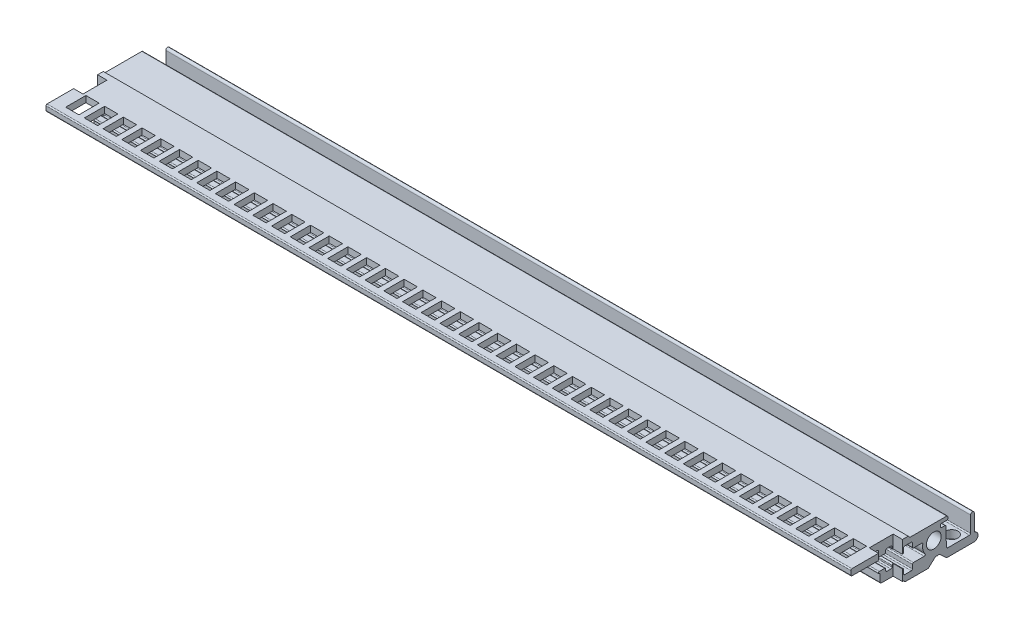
SolidWorks part; units mm, degrees
ref_plane "前视基准面" through (0, 0, 0) normal (0, 0, 1) x (1, 0, 0)
ref_plane "上视基准面" through (0, 0, 0) normal (0, 1, 0) x (1, 0, 0)
ref_plane "右视基准面" through (0, 0, 0) normal (1, 0, 0) x (0, 0, -1)
sketch "草图1" plane through (0, 0, 0) normal (1, 0, 0) x (0, 0, -1)
  line L901 (2.0061, 2.1458) -> (2.0561, 2.1458)
  line L902 (2.2561, 1.9458) -> (2.2561, -0.0542)
  line L903 (2.5561, -0.3542) -> (6.0561, -0.3542)
  line L904 (6.546, -0.7542) -> (12.6401, -0.7542)
  line L905 (12.8419, -0.6762) -> (14.6823, 0.9969)
  line L906 (15.8298, 0.9969) -> (17.6702, -0.6762)
  line L907 (17.872, -0.7542) -> (25.1561, -0.7542)
  line L908 (25.2561, 1.6874) -> (25.2561, 6.0458)
  line L909 (24.2561, 6.0458) -> (24.2561, 1.7458)
  line L910 (23.9561, 1.4458) -> (18.0561, 1.4458)
  line L911 (17.7561, 1.7458) -> (17.7561, 3.0993)
  line L912 (17.5561, 3.4458) -> (17.5561, 6.7458)
  line L913 (17.2561, 7.0458) -> (16.3561, 7.0458)
  line L914 (16.0561, 7.3458) -> (16.0561, 7.7458)
  line L915 (16.3561, 8.0458) -> (17.7561, 8.0458)
  line L916 (18.0561, 8.3458) -> (18.0561, 8.7458)
  line L917 (17.7561, 9.0458) -> (-7.9439, 9.0458)
  line L918 (-8.2439, 8.7458) -> (-8.2439, 8.1458)
  line L919 (-7.9439, 7.8458) -> (1.4561, 7.8458)
  line L920 (1.7561, 7.5458) -> (1.7561, 6.3458)
  line L921 (2.0561, 6.0458) -> (3.4561, 6.0458)
  line L922 (3.7561, 6.3458) -> (3.7561, 6.7458)
  line L923 (4.0561, 7.0458) -> (5.1561, 7.0458)
  line L924 (5.4561, 6.7458) -> (5.4561, 6.3458)
  line L925 (6.0561, 6.3458) -> (6.0561, 7.4058)
  line L926 (6.3561, 7.7058) -> (8.1561, 7.7058)
  line L927 (8.4561, 7.4058) -> (8.4561, 6.3458)
  line L928 (8.7561, 6.0458) -> (10.98, 6.0458)
  line L929 (11.646, 2.6458) -> (8.7561, 2.6458)
  line L930 (8.4561, 2.3458) -> (8.4561, 1.2858)
  line L931 (8.1561, 0.9858) -> (6.3561, 0.9858)
  line L932 (6.0561, 1.2858) -> (6.0561, 2.3458)
  line L933 (5.4561, 2.3458) -> (5.4561, 1.9458)
  line L934 (5.1561, 1.6458) -> (4.0561, 1.6458)
  line L935 (3.7561, 1.9458) -> (3.7561, 2.3458)
  line L936 (3.4561, 2.6458) -> (2.0061, 2.6458)
  circle A0 centre (14.2561, 5.0458) radius 2
  arc A133 (2.0061, 2.6458) -> (2.0061, 2.1458) centre (2.0061, 2.3958) ccw
  arc A134 (2.2561, 1.9458) -> (2.0561, 2.1458) centre (2.0561, 1.9458) ccw
  arc A135 (2.2561, -0.0542) -> (2.5561, -0.3542) centre (2.5561, -0.0542) ccw
  arc A136 (6.35, -0.5942) -> (6.0561, -0.3542) centre (6.0561, -0.6542) ccw
  arc A137 (6.35, -0.5942) -> (6.546, -0.7542) centre (6.546, -0.5542) ccw
  arc A138 (12.6401, -0.7542) -> (12.8419, -0.6762) centre (12.6401, -0.4542) ccw
  arc A139 (15.0701, 1.0103) -> (14.6823, 0.9969) centre (14.8841, 0.7749) ccw
  arc A140 (15.0701, 1.0103) -> (15.442, 1.0103) centre (15.2561, 1.2458) ccw
  arc A141 (15.8298, 0.9969) -> (15.442, 1.0103) centre (15.628, 0.7749) ccw
  arc A142 (17.6702, -0.6762) -> (17.872, -0.7542) centre (17.872, -0.4542) ccw
  arc A143 (25.1561, -0.7542) -> (25.4703, 1.3999) centre (25.1561, 0.3458) ccw
  arc A144 (25.2561, 1.6874) -> (25.4703, 1.3999) centre (25.5561, 1.6874) ccw
  arc A145 (25.2561, 6.0458) -> (24.2561, 6.0458) centre (24.7561, 6.0458) ccw
  arc A146 (23.9561, 1.4458) -> (24.2561, 1.7458) centre (23.9561, 1.7458) ccw
  arc A147 (17.7561, 1.7458) -> (18.0561, 1.4458) centre (18.0561, 1.7458) ccw
  arc A148 (17.7561, 3.0993) -> (17.6561, 3.2726) centre (17.5561, 3.0993) ccw
  arc A149 (17.5561, 3.4458) -> (17.6561, 3.2726) centre (17.7561, 3.4458) ccw
  arc A150 (17.5561, 6.7458) -> (17.2561, 7.0458) centre (17.2561, 6.7458) ccw
  arc A151 (16.0561, 7.3458) -> (16.3561, 7.0458) centre (16.3561, 7.3458) ccw
  arc A152 (16.3561, 8.0458) -> (16.0561, 7.7458) centre (16.3561, 7.7458) ccw
  arc A153 (17.7561, 8.0458) -> (18.0561, 8.3458) centre (17.7561, 8.3458) ccw
  arc A154 (18.0561, 8.7458) -> (17.7561, 9.0458) centre (17.7561, 8.7458) ccw
  arc A155 (-7.9439, 9.0458) -> (-8.2439, 8.7458) centre (-7.9439, 8.7458) ccw
  arc A156 (-8.2439, 8.1458) -> (-7.9439, 7.8458) centre (-7.9439, 8.1458) ccw
  arc A157 (1.7561, 7.5458) -> (1.4561, 7.8458) centre (1.4561, 7.5458) ccw
  arc A158 (1.7561, 6.3458) -> (2.0561, 6.0458) centre (2.0561, 6.3458) ccw
  arc A159 (3.4561, 6.0458) -> (3.7561, 6.3458) centre (3.4561, 6.3458) ccw
  arc A160 (4.0561, 7.0458) -> (3.7561, 6.7458) centre (4.0561, 6.7458) ccw
  arc A161 (5.4561, 6.7458) -> (5.1561, 7.0458) centre (5.1561, 6.7458) ccw
  arc A162 (5.4561, 6.3458) -> (6.0561, 6.3458) centre (5.7561, 6.3458) ccw
  arc A163 (6.3561, 7.7058) -> (6.0561, 7.4058) centre (6.3561, 7.4058) ccw
  arc A164 (8.4561, 7.4058) -> (8.1561, 7.7058) centre (8.1561, 7.4058) ccw
  arc A165 (8.4561, 6.3458) -> (8.7561, 6.0458) centre (8.7561, 6.3458) ccw
  arc A166 (11.2734, 5.6831) -> (10.98, 6.0458) centre (10.98, 5.7458) ccw
  arc A167 (11.2734, 5.6831) -> (11.8797, 3.1338) centre (14.2561, 5.0458) ccw
  arc A168 (11.646, 2.6458) -> (11.8797, 3.1338) centre (11.646, 2.9458) ccw
  arc A169 (8.7561, 2.6458) -> (8.4561, 2.3458) centre (8.7561, 2.3458) ccw
  arc A170 (8.1561, 0.9858) -> (8.4561, 1.2858) centre (8.1561, 1.2858) ccw
  arc A171 (6.0561, 1.2858) -> (6.3561, 0.9858) centre (6.3561, 1.2858) ccw
  arc A172 (6.0561, 2.3458) -> (5.4561, 2.3458) centre (5.7561, 2.3458) ccw
  arc A173 (5.1561, 1.6458) -> (5.4561, 1.9458) centre (5.1561, 1.9458) ccw
  arc A174 (3.7561, 1.9458) -> (4.0561, 1.6458) centre (4.0561, 1.9458) ccw
  arc A175 (3.7561, 2.3458) -> (3.4561, 2.6458) centre (3.4561, 2.3458) ccw
  dimension "D2" = 0.3
  dimension "D3" = 0.3
  dimension "D6" = 4
  dimension "D1" = 0.6
  dimension "D4" = 25.7
  dimension "D5" = 9.4
extrude "凸台-拉伸1" add sketch "草图1" along normal mid plane 218.44
sketch "草图7" plane through (109.22, 0, 0) normal (1, 0, 0) x (0, 0, -1)
  line L0 (-7.9439, 9.0458) -> (-8.2439, 9.0458)
  line L1 (-8.2439, 9.0458) -> (-8.2439, 8.7458)
  arc A0 (-7.9439, 9.0458) -> (-8.2439, 8.7458) centre (-7.9439, 8.7458) ccw construction
  arc A1 (-7.9439, 9.0458) -> (-8.2439, 8.7458) centre (-7.9439, 8.7458) ccw
extrude "凸台-拉伸4" add sketch "草图7" against normal through all
sketch "草图6" plane through (-109.22, 0, 0) normal (-1, 0, 0) x (0, 0, 1)
  line L0 (-7.8061, 9.0458) -> (8.2439, 9.0458)
  line L1 (-17.7561, 9.0458) -> (8.2439, 9.0458) construction
  line L4 (8.2439, 9.0458) -> (8.2439, 9.5458)
  line L5 (8.2439, 9.5458) -> (-7.3061, 9.5458)
  line L6 (-7.3061, 9.5458) -> (-7.8061, 9.0458)
extrude "凸台-拉伸3" add sketch "草图6" against normal through all
sketch "草图3" plane through (0, 9.5458, 0) normal (0, 1, 0) x (1, 0, 0)
  line L0 (109.22, 17.7561) -> (109.22, 7.8061) construction
  line L1 (109.22, 5.7561) -> (106.68, 5.7561)
  line L2 (109.22, 5.7561) -> (109.22, -0.7439)
  line L3 (109.22, -0.7439) -> (106.68, -0.7439)
  line L4 (106.68, 5.7561) -> (106.68, -0.7439)
  line L5 (109.22, -8.2439) -> (-109.22, -8.2439) construction
  line L7 (0, -8.2439) -> (0, 17.7561) construction
  line L9 (109.22, 17.7561) -> (-109.22, 17.7561) construction
  line L10 (-106.68, 5.7561) -> (-106.68, -0.7439)
  line L11 (-109.22, -0.7439) -> (-106.68, -0.7439)
  line L12 (-109.22, 5.7561) -> (-109.22, -0.7439)
  line L13 (-109.22, 5.7561) -> (-106.68, 5.7561)
  dimension "D1" = 2.54
  dimension "D2" = 7.5
  dimension "D3" = 6.5
extrude "切除-拉伸1" cut sketch "草图3" against normal up to surface (10.3 mm away)
sketch "草图4" plane through (0, -0.7542, 0) normal (0, -1, 0) x (-1, 0, 0)
  line L0 (-106.68, 1.7561) -> (106.68, 1.7561) construction
  line L1 (-109.22, 17.872) -> (-109.22, 25.1561) construction
  circle A0 centre (-106.68, 21.7061) radius 1.65
  circle A1 centre (-101.6, 21.7061) radius 1.65
  circle A2 centre (-96.52, 21.7061) radius 1.65
  circle A3 centre (-91.44, 21.7061) radius 1.65
  circle A4 centre (-86.36, 21.7061) radius 1.65
  circle A5 centre (-81.28, 21.7061) radius 1.65
  circle A6 centre (-76.2, 21.7061) radius 1.65
  circle A7 centre (-71.12, 21.7061) radius 1.65
  circle A8 centre (-66.04, 21.7061) radius 1.65
  circle A9 centre (-60.96, 21.7061) radius 1.65
  circle A10 centre (-55.88, 21.7061) radius 1.65
  circle A11 centre (-50.8, 21.7061) radius 1.65
  circle A12 centre (-45.72, 21.7061) radius 1.65
  circle A13 centre (-40.64, 21.7061) radius 1.65
  circle A14 centre (-35.56, 21.7061) radius 1.65
  circle A15 centre (-30.48, 21.7061) radius 1.65
  circle A16 centre (-25.4, 21.7061) radius 1.65
  circle A17 centre (-20.32, 21.7061) radius 1.65
  circle A18 centre (-15.24, 21.7061) radius 1.65
  circle A19 centre (-10.16, 21.7061) radius 1.65
  circle A20 centre (-5.08, 21.7061) radius 1.65
  circle A21 centre (0, 21.7061) radius 1.65
  circle A22 centre (5.08, 21.7061) radius 1.65
  circle A23 centre (10.16, 21.7061) radius 1.65
  circle A24 centre (15.24, 21.7061) radius 1.65
  circle A25 centre (20.32, 21.7061) radius 1.65
  circle A26 centre (25.4, 21.7061) radius 1.65
  circle A27 centre (30.48, 21.7061) radius 1.65
  circle A28 centre (35.56, 21.7061) radius 1.65
  circle A29 centre (40.64, 21.7061) radius 1.65
  circle A30 centre (45.72, 21.7061) radius 1.65
  circle A31 centre (50.8, 21.7061) radius 1.65
  circle A32 centre (55.88, 21.7061) radius 1.65
  circle A33 centre (60.96, 21.7061) radius 1.65
  circle A34 centre (66.04, 21.7061) radius 1.65
  circle A35 centre (71.12, 21.7061) radius 1.65
  circle A36 centre (76.2, 21.7061) radius 1.65
  circle A37 centre (81.28, 21.7061) radius 1.65
  circle A38 centre (86.36, 21.7061) radius 1.65
  circle A39 centre (91.44, 21.7061) radius 1.65
  circle A40 centre (96.52, 21.7061) radius 1.65
  circle A41 centre (101.6, 21.7061) radius 1.65
  circle A42 centre (106.68, 21.7061) radius 1.65
extrude "切除-拉伸2" cut sketch "草图4" against normal up to surface (9.8 mm away)
sketch "草图5" plane through (0, 9.5458, 0) normal (0, 1, 0) x (1, 0, 0)
  line L0 (-109.22, 17.7561) -> (-109.22, 7.8061) construction
  line L1 (-102.34, -6.1939) -> (-105.94, -6.1939)
  line L2 (-102.34, -6.1939) -> (-102.34, -0.6939)
  line L3 (-102.34, -0.6939) -> (-105.94, -0.6939)
  line L4 (-105.94, -6.1939) -> (-105.94, -0.6939)
  line L5 (-102.34, -6.1939) -> (-105.94, -0.6939) construction
  line L6 (-102.34, -0.6939) -> (-105.94, -6.1939) construction
  line L8 (-97.26, -6.1939) -> (-100.86, -6.1939)
  line L9 (-97.26, -6.1939) -> (-97.26, -0.6939)
  line L10 (-97.26, -0.6939) -> (-100.86, -0.6939)
  line L11 (-100.86, -6.1939) -> (-100.86, -0.6939)
  line L12 (-97.26, -6.1939) -> (-100.86, -0.6939) construction
  line L13 (-97.26, -0.6939) -> (-100.86, -6.1939) construction
  line L14 (-92.18, -6.1939) -> (-95.78, -6.1939)
  line L15 (-92.18, -6.1939) -> (-92.18, -0.6939)
  line L16 (-92.18, -0.6939) -> (-95.78, -0.6939)
  line L17 (-95.78, -6.1939) -> (-95.78, -0.6939)
  line L18 (-92.18, -6.1939) -> (-95.78, -0.6939) construction
  line L19 (-92.18, -0.6939) -> (-95.78, -6.1939) construction
  line L20 (-87.1, -6.1939) -> (-90.7, -6.1939)
  line L21 (-87.1, -6.1939) -> (-87.1, -0.6939)
  line L22 (-87.1, -0.6939) -> (-90.7, -0.6939)
  line L23 (-90.7, -6.1939) -> (-90.7, -0.6939)
  line L24 (-87.1, -6.1939) -> (-90.7, -0.6939) construction
  line L25 (-87.1, -0.6939) -> (-90.7, -6.1939) construction
  line L26 (-82.02, -6.1939) -> (-85.62, -6.1939)
  line L27 (-82.02, -6.1939) -> (-82.02, -0.6939)
  line L28 (-82.02, -0.6939) -> (-85.62, -0.6939)
  line L29 (-85.62, -6.1939) -> (-85.62, -0.6939)
  line L30 (-82.02, -6.1939) -> (-85.62, -0.6939) construction
  line L31 (-82.02, -0.6939) -> (-85.62, -6.1939) construction
  line L32 (-76.94, -6.1939) -> (-80.54, -6.1939)
  line L33 (-76.94, -6.1939) -> (-76.94, -0.6939)
  line L34 (-76.94, -0.6939) -> (-80.54, -0.6939)
  line L35 (-80.54, -6.1939) -> (-80.54, -0.6939)
  line L36 (-76.94, -6.1939) -> (-80.54, -0.6939) construction
  line L37 (-76.94, -0.6939) -> (-80.54, -6.1939) construction
  line L38 (-71.86, -6.1939) -> (-75.46, -6.1939)
  line L39 (-71.86, -6.1939) -> (-71.86, -0.6939)
  line L40 (-71.86, -0.6939) -> (-75.46, -0.6939)
  line L41 (-75.46, -6.1939) -> (-75.46, -0.6939)
  line L42 (-71.86, -6.1939) -> (-75.46, -0.6939) construction
  line L43 (-71.86, -0.6939) -> (-75.46, -6.1939) construction
  line L44 (-66.78, -6.1939) -> (-70.38, -6.1939)
  line L45 (-66.78, -6.1939) -> (-66.78, -0.6939)
  line L46 (-66.78, -0.6939) -> (-70.38, -0.6939)
  line L47 (-70.38, -6.1939) -> (-70.38, -0.6939)
  line L48 (-66.78, -6.1939) -> (-70.38, -0.6939) construction
  line L49 (-66.78, -0.6939) -> (-70.38, -6.1939) construction
  line L50 (-61.7, -6.1939) -> (-65.3, -6.1939)
  line L51 (-61.7, -6.1939) -> (-61.7, -0.6939)
  line L52 (-61.7, -0.6939) -> (-65.3, -0.6939)
  line L53 (-65.3, -6.1939) -> (-65.3, -0.6939)
  line L54 (-61.7, -6.1939) -> (-65.3, -0.6939) construction
  line L55 (-61.7, -0.6939) -> (-65.3, -6.1939) construction
  line L56 (-56.62, -6.1939) -> (-60.22, -6.1939)
  line L57 (-56.62, -6.1939) -> (-56.62, -0.6939)
  line L58 (-56.62, -0.6939) -> (-60.22, -0.6939)
  line L59 (-60.22, -6.1939) -> (-60.22, -0.6939)
  line L60 (-56.62, -6.1939) -> (-60.22, -0.6939) construction
  line L61 (-56.62, -0.6939) -> (-60.22, -6.1939) construction
  line L62 (-51.54, -6.1939) -> (-55.14, -6.1939)
  line L63 (-51.54, -6.1939) -> (-51.54, -0.6939)
  line L64 (-51.54, -0.6939) -> (-55.14, -0.6939)
  line L65 (-55.14, -6.1939) -> (-55.14, -0.6939)
  line L66 (-51.54, -6.1939) -> (-55.14, -0.6939) construction
  line L67 (-51.54, -0.6939) -> (-55.14, -6.1939) construction
  line L68 (-46.46, -6.1939) -> (-50.06, -6.1939)
  line L69 (-46.46, -6.1939) -> (-46.46, -0.6939)
  line L70 (-46.46, -0.6939) -> (-50.06, -0.6939)
  line L71 (-50.06, -6.1939) -> (-50.06, -0.6939)
  line L72 (-46.46, -6.1939) -> (-50.06, -0.6939) construction
  line L73 (-46.46, -0.6939) -> (-50.06, -6.1939) construction
  line L74 (-41.38, -6.1939) -> (-44.98, -6.1939)
  line L75 (-41.38, -6.1939) -> (-41.38, -0.6939)
  line L76 (-41.38, -0.6939) -> (-44.98, -0.6939)
  line L77 (-44.98, -6.1939) -> (-44.98, -0.6939)
  line L78 (-41.38, -6.1939) -> (-44.98, -0.6939) construction
  line L79 (-41.38, -0.6939) -> (-44.98, -6.1939) construction
  line L80 (-36.3, -6.1939) -> (-39.9, -6.1939)
  line L81 (-36.3, -6.1939) -> (-36.3, -0.6939)
  line L82 (-36.3, -0.6939) -> (-39.9, -0.6939)
  line L83 (-39.9, -6.1939) -> (-39.9, -0.6939)
  line L84 (-36.3, -6.1939) -> (-39.9, -0.6939) construction
  line L85 (-36.3, -0.6939) -> (-39.9, -6.1939) construction
  line L86 (-31.22, -6.1939) -> (-34.82, -6.1939)
  line L87 (-31.22, -6.1939) -> (-31.22, -0.6939)
  line L88 (-31.22, -0.6939) -> (-34.82, -0.6939)
  line L89 (-34.82, -6.1939) -> (-34.82, -0.6939)
  line L90 (-31.22, -6.1939) -> (-34.82, -0.6939) construction
  line L91 (-31.22, -0.6939) -> (-34.82, -6.1939) construction
  line L92 (-26.14, -6.1939) -> (-29.74, -6.1939)
  line L93 (-26.14, -6.1939) -> (-26.14, -0.6939)
  line L94 (-26.14, -0.6939) -> (-29.74, -0.6939)
  line L95 (-29.74, -6.1939) -> (-29.74, -0.6939)
  line L96 (-26.14, -6.1939) -> (-29.74, -0.6939) construction
  line L97 (-26.14, -0.6939) -> (-29.74, -6.1939) construction
  line L98 (-21.06, -6.1939) -> (-24.66, -6.1939)
  line L99 (-21.06, -6.1939) -> (-21.06, -0.6939)
  line L100 (-21.06, -0.6939) -> (-24.66, -0.6939)
  line L101 (-24.66, -6.1939) -> (-24.66, -0.6939)
  line L102 (-21.06, -6.1939) -> (-24.66, -0.6939) construction
  line L103 (-21.06, -0.6939) -> (-24.66, -6.1939) construction
  line L104 (-15.98, -6.1939) -> (-19.58, -6.1939)
  line L105 (-15.98, -6.1939) -> (-15.98, -0.6939)
  line L106 (-15.98, -0.6939) -> (-19.58, -0.6939)
  line L107 (-19.58, -6.1939) -> (-19.58, -0.6939)
  line L108 (-15.98, -6.1939) -> (-19.58, -0.6939) construction
  line L109 (-15.98, -0.6939) -> (-19.58, -6.1939) construction
  line L110 (-10.9, -6.1939) -> (-14.5, -6.1939)
  line L111 (-10.9, -6.1939) -> (-10.9, -0.6939)
  line L112 (-10.9, -0.6939) -> (-14.5, -0.6939)
  line L113 (-14.5, -6.1939) -> (-14.5, -0.6939)
  line L114 (-10.9, -6.1939) -> (-14.5, -0.6939) construction
  line L115 (-10.9, -0.6939) -> (-14.5, -6.1939) construction
  line L116 (-5.82, -6.1939) -> (-9.42, -6.1939)
  line L117 (-5.82, -6.1939) -> (-5.82, -0.6939)
  line L118 (-5.82, -0.6939) -> (-9.42, -0.6939)
  line L119 (-9.42, -6.1939) -> (-9.42, -0.6939)
  line L120 (-5.82, -6.1939) -> (-9.42, -0.6939) construction
  line L121 (-5.82, -0.6939) -> (-9.42, -6.1939) construction
  line L122 (-0.74, -6.1939) -> (-4.34, -6.1939)
  line L123 (-0.74, -6.1939) -> (-0.74, -0.6939)
  line L124 (-0.74, -0.6939) -> (-4.34, -0.6939)
  line L125 (-4.34, -6.1939) -> (-4.34, -0.6939)
  line L126 (-0.74, -6.1939) -> (-4.34, -0.6939) construction
  line L127 (-0.74, -0.6939) -> (-4.34, -6.1939) construction
  line L128 (4.34, -6.1939) -> (0.74, -6.1939)
  line L129 (4.34, -6.1939) -> (4.34, -0.6939)
  line L130 (4.34, -0.6939) -> (0.74, -0.6939)
  line L131 (0.74, -6.1939) -> (0.74, -0.6939)
  line L132 (4.34, -6.1939) -> (0.74, -0.6939) construction
  line L133 (4.34, -0.6939) -> (0.74, -6.1939) construction
  line L134 (9.42, -6.1939) -> (5.82, -6.1939)
  line L135 (9.42, -6.1939) -> (9.42, -0.6939)
  line L136 (9.42, -0.6939) -> (5.82, -0.6939)
  line L137 (5.82, -6.1939) -> (5.82, -0.6939)
  line L138 (9.42, -6.1939) -> (5.82, -0.6939) construction
  line L139 (9.42, -0.6939) -> (5.82, -6.1939) construction
  line L140 (14.5, -6.1939) -> (10.9, -6.1939)
  line L141 (14.5, -6.1939) -> (14.5, -0.6939)
  line L142 (14.5, -0.6939) -> (10.9, -0.6939)
  line L143 (10.9, -6.1939) -> (10.9, -0.6939)
  line L144 (14.5, -6.1939) -> (10.9, -0.6939) construction
  line L145 (14.5, -0.6939) -> (10.9, -6.1939) construction
  line L146 (19.58, -6.1939) -> (15.98, -6.1939)
  line L147 (19.58, -6.1939) -> (19.58, -0.6939)
  line L148 (19.58, -0.6939) -> (15.98, -0.6939)
  line L149 (15.98, -6.1939) -> (15.98, -0.6939)
  line L150 (19.58, -6.1939) -> (15.98, -0.6939) construction
  line L151 (19.58, -0.6939) -> (15.98, -6.1939) construction
  line L152 (24.66, -6.1939) -> (21.06, -6.1939)
  line L153 (24.66, -6.1939) -> (24.66, -0.6939)
  line L154 (24.66, -0.6939) -> (21.06, -0.6939)
  line L155 (21.06, -6.1939) -> (21.06, -0.6939)
  line L156 (24.66, -6.1939) -> (21.06, -0.6939) construction
  line L157 (24.66, -0.6939) -> (21.06, -6.1939) construction
  line L158 (29.74, -6.1939) -> (26.14, -6.1939)
  line L159 (29.74, -6.1939) -> (29.74, -0.6939)
  line L160 (29.74, -0.6939) -> (26.14, -0.6939)
  line L161 (26.14, -6.1939) -> (26.14, -0.6939)
  line L162 (29.74, -6.1939) -> (26.14, -0.6939) construction
  line L163 (29.74, -0.6939) -> (26.14, -6.1939) construction
  line L164 (34.82, -6.1939) -> (31.22, -6.1939)
  line L165 (34.82, -6.1939) -> (34.82, -0.6939)
  line L166 (34.82, -0.6939) -> (31.22, -0.6939)
  line L167 (31.22, -6.1939) -> (31.22, -0.6939)
  line L168 (34.82, -6.1939) -> (31.22, -0.6939) construction
  line L169 (34.82, -0.6939) -> (31.22, -6.1939) construction
  line L170 (39.9, -6.1939) -> (36.3, -6.1939)
  line L171 (39.9, -6.1939) -> (39.9, -0.6939)
  line L172 (39.9, -0.6939) -> (36.3, -0.6939)
  line L173 (36.3, -6.1939) -> (36.3, -0.6939)
  line L174 (39.9, -6.1939) -> (36.3, -0.6939) construction
  line L175 (39.9, -0.6939) -> (36.3, -6.1939) construction
  line L176 (44.98, -6.1939) -> (41.38, -6.1939)
  line L177 (44.98, -6.1939) -> (44.98, -0.6939)
  line L178 (44.98, -0.6939) -> (41.38, -0.6939)
  line L179 (41.38, -6.1939) -> (41.38, -0.6939)
  line L180 (44.98, -6.1939) -> (41.38, -0.6939) construction
  line L181 (44.98, -0.6939) -> (41.38, -6.1939) construction
  line L182 (50.06, -6.1939) -> (46.46, -6.1939)
  line L183 (50.06, -6.1939) -> (50.06, -0.6939)
  line L184 (50.06, -0.6939) -> (46.46, -0.6939)
  line L185 (46.46, -6.1939) -> (46.46, -0.6939)
  line L186 (50.06, -6.1939) -> (46.46, -0.6939) construction
  line L187 (50.06, -0.6939) -> (46.46, -6.1939) construction
  line L188 (55.14, -6.1939) -> (51.54, -6.1939)
  line L189 (55.14, -6.1939) -> (55.14, -0.6939)
  line L190 (55.14, -0.6939) -> (51.54, -0.6939)
  line L191 (51.54, -6.1939) -> (51.54, -0.6939)
  line L192 (55.14, -6.1939) -> (51.54, -0.6939) construction
  line L193 (55.14, -0.6939) -> (51.54, -6.1939) construction
  line L194 (60.22, -6.1939) -> (56.62, -6.1939)
  line L195 (60.22, -6.1939) -> (60.22, -0.6939)
  line L196 (60.22, -0.6939) -> (56.62, -0.6939)
  line L197 (56.62, -6.1939) -> (56.62, -0.6939)
  line L198 (60.22, -6.1939) -> (56.62, -0.6939) construction
  line L199 (60.22, -0.6939) -> (56.62, -6.1939) construction
  line L200 (65.3, -6.1939) -> (61.7, -6.1939)
  line L201 (65.3, -6.1939) -> (65.3, -0.6939)
  line L202 (65.3, -0.6939) -> (61.7, -0.6939)
  line L203 (61.7, -6.1939) -> (61.7, -0.6939)
  line L204 (65.3, -6.1939) -> (61.7, -0.6939) construction
  line L205 (65.3, -0.6939) -> (61.7, -6.1939) construction
  line L206 (70.38, -6.1939) -> (66.78, -6.1939)
  line L207 (70.38, -6.1939) -> (70.38, -0.6939)
  line L208 (70.38, -0.6939) -> (66.78, -0.6939)
  line L209 (66.78, -6.1939) -> (66.78, -0.6939)
  line L210 (70.38, -6.1939) -> (66.78, -0.6939) construction
  line L211 (70.38, -0.6939) -> (66.78, -6.1939) construction
  line L212 (75.46, -6.1939) -> (71.86, -6.1939)
  line L213 (75.46, -6.1939) -> (75.46, -0.6939)
  line L214 (75.46, -0.6939) -> (71.86, -0.6939)
  line L215 (71.86, -6.1939) -> (71.86, -0.6939)
  line L216 (75.46, -6.1939) -> (71.86, -0.6939) construction
  line L217 (75.46, -0.6939) -> (71.86, -6.1939) construction
  line L218 (80.54, -6.1939) -> (76.94, -6.1939)
  line L219 (80.54, -6.1939) -> (80.54, -0.6939)
  line L220 (80.54, -0.6939) -> (76.94, -0.6939)
  line L221 (76.94, -6.1939) -> (76.94, -0.6939)
  line L222 (80.54, -6.1939) -> (76.94, -0.6939) construction
  line L223 (80.54, -0.6939) -> (76.94, -6.1939) construction
  line L224 (85.62, -6.1939) -> (82.02, -6.1939)
  line L225 (85.62, -6.1939) -> (85.62, -0.6939)
  line L226 (85.62, -0.6939) -> (82.02, -0.6939)
  line L227 (82.02, -6.1939) -> (82.02, -0.6939)
  line L228 (85.62, -6.1939) -> (82.02, -0.6939) construction
  line L229 (85.62, -0.6939) -> (82.02, -6.1939) construction
  line L230 (90.7, -6.1939) -> (87.1, -6.1939)
  line L231 (90.7, -6.1939) -> (90.7, -0.6939)
  line L232 (90.7, -0.6939) -> (87.1, -0.6939)
  line L233 (87.1, -6.1939) -> (87.1, -0.6939)
  line L234 (90.7, -6.1939) -> (87.1, -0.6939) construction
  line L235 (90.7, -0.6939) -> (87.1, -6.1939) construction
  line L236 (95.78, -6.1939) -> (92.18, -6.1939)
  line L237 (95.78, -6.1939) -> (95.78, -0.6939)
  line L238 (95.78, -0.6939) -> (92.18, -0.6939)
  line L239 (92.18, -6.1939) -> (92.18, -0.6939)
  line L240 (95.78, -6.1939) -> (92.18, -0.6939) construction
  line L241 (95.78, -0.6939) -> (92.18, -6.1939) construction
  line L242 (100.86, -6.1939) -> (97.26, -6.1939)
  line L243 (100.86, -6.1939) -> (100.86, -0.6939)
  line L244 (100.86, -0.6939) -> (97.26, -0.6939)
  line L245 (97.26, -6.1939) -> (97.26, -0.6939)
  line L246 (100.86, -6.1939) -> (97.26, -0.6939) construction
  line L247 (100.86, -0.6939) -> (97.26, -6.1939) construction
  line L248 (105.94, -6.1939) -> (102.34, -6.1939)
  line L249 (105.94, -6.1939) -> (105.94, -0.6939)
  line L250 (105.94, -0.6939) -> (102.34, -0.6939)
  line L251 (102.34, -6.1939) -> (102.34, -0.6939)
  line L252 (105.94, -6.1939) -> (102.34, -0.6939) construction
  line L253 (105.94, -0.6939) -> (102.34, -6.1939) construction
  line L506 (109.22, -8.2439) -> (-109.22, -8.2439) construction
  point P0 (-104.14, -3.4439)
  point P10 (-99.06, -3.4439)
  point P15 (-93.98, -3.4439)
  point P20 (-88.9, -3.4439)
  point P25 (-83.82, -3.4439)
  point P30 (-78.74, -3.4439)
  point P35 (-73.66, -3.4439)
  point P40 (-68.58, -3.4439)
  point P45 (-63.5, -3.4439)
  point P50 (-58.42, -3.4439)
  point P55 (-53.34, -3.4439)
  point P60 (-48.26, -3.4439)
  point P65 (-43.18, -3.4439)
  point P70 (-38.1, -3.4439)
  point P75 (-33.02, -3.4439)
  point P80 (-27.94, -3.4439)
  point P85 (-22.86, -3.4439)
  point P90 (-17.78, -3.4439)
  point P95 (-12.7, -3.4439)
  point P100 (-7.62, -3.4439)
  point P105 (-2.54, -3.4439)
  point P110 (2.54, -3.4439)
  point P115 (7.62, -3.4439)
  point P120 (12.7, -3.4439)
  point P125 (17.78, -3.4439)
  point P130 (22.86, -3.4439)
  point P135 (27.94, -3.4439)
  point P140 (33.02, -3.4439)
  point P145 (38.1, -3.4439)
  point P150 (43.18, -3.4439)
  point P155 (48.26, -3.4439)
  point P160 (53.34, -3.4439)
  point P165 (58.42, -3.4439)
  point P170 (63.5, -3.4439)
  point P175 (68.58, -3.4439)
  point P180 (73.66, -3.4439)
  point P185 (78.74, -3.4439)
  point P190 (83.82, -3.4439)
  point P195 (88.9, -3.4439)
  point P200 (93.98, -3.4439)
  point P205 (99.06, -3.4439)
  point P210 (104.14, -3.4439)
extrude "切除-拉伸3" cut sketch "草图5" against normal up to surface (9.9 mm away)
fillet "圆角1" radius 0.3 1 edges at (0, 9.5458, 8.2439)
equation "\"D4@草图4\"=\"D1@凸台-拉伸1\"/5.08"
equation "\"D5@草图5\"=\"D1@凸台-拉伸1\"/5.08-1"
